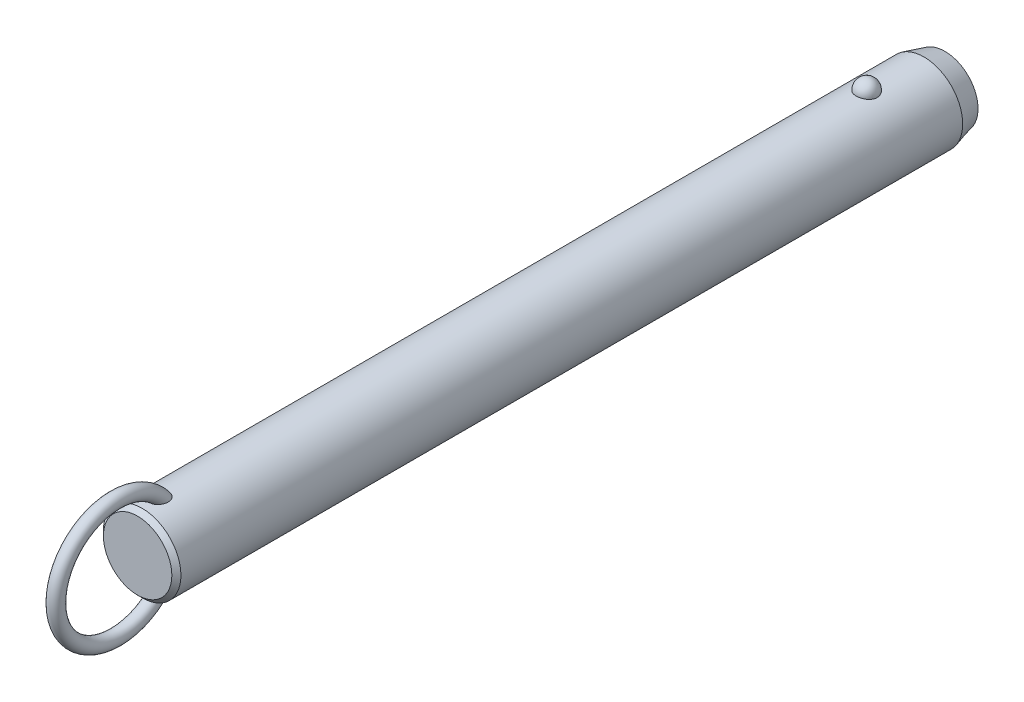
SolidWorks part; units mm, degrees
ref_plane "Front Plane" through (0, 0, 0) normal (0, 0, 1) x (1, 0, 0)
ref_plane "Top Plane" through (0, 0, 0) normal (0, 1, 0) x (1, 0, 0)
ref_plane "Right Plane" through (0, 0, 0) normal (1, 0, 0) x (0, 0, -1)
sketch "Sketch2" plane through (0, 0, 0) normal (0, 0, 1) x (1, 0, 0)
  circle A0 centre (0, 0) radius 11.1
  point P3 (0, 11.1)
  dimension "D1" = 22.2
extrude "Boss-Extrude1" add sketch "Sketch2" along normal blind 193
sketch "Sketch3" plane through (0, 0, 0) normal (0, 0, -1) x (-1, 0, 0)
  circle A0 centre (0, 0) radius 11.1
  dimension "D1" = 22.2
extrude "Boss-Extrude2" add sketch "Sketch3" along normal blind 25.4
chamfer "Chamfer1" distance 6 angle 15 1 edges at (-11.1, 0, -25.4)
sketch "Sketch12" plane through (0, 0, 0) normal (1, 0, 0) x (0, 0, -1)
  line L0 (-193, 11.1) -> (-193, -11.1) construction
  point P0 (-193, 0)
sketch "Sketch13" plane through (0, 0, 0) normal (1, 0, 0) x (0, 0, -1)
  circle A0 centre (-212.05, 0) radius 19.05
  point P2 (-193, 0)
  dimension "D1" = 38.1
sketch "Sketch14" plane through (0, 0, 0) normal (0, 1, 0) x (1, 0, 0)
  circle A0 centre (0, -195) radius 2
  point P2 (0, -193)
  dimension "D1" = 4
sweep "Sweep1" add profiles "Sketch14" path "Sketch13"
sketch "Sketch15" plane through (0, 0, 193) normal (0, 0, 1) x (1, 0, 0)
  circle A0 centre (0, 0) radius 11.1
  dimension "D1" = 22.2
extrude "Boss-Extrude3" add sketch "Sketch15" along normal blind 12.7
chamfer "Chamfer2" distance 1.3 angle 45 1 edges at (11.1, 0, 205.7)
sketch "Sketch18" plane through (0, 0, 0) normal (1, 0, 0) x (0, 0, -1)
  line L0 (19.4, 11.1) -> (-196.568, 11.1) construction
  line L1 (3, 14.1) -> (3, 8.1)
  line L2 (-196.568, -11.1) -> (19.4, -11.1) construction
  arc A0 (3, 14.1) -> (3, 8.1) centre (3, 11.1) ccw
  point P4 (0, 11.1)
  dimension "D1" = 25.2
revolve "Revolve1" add sketch "Sketch18" angle 360 about L1
